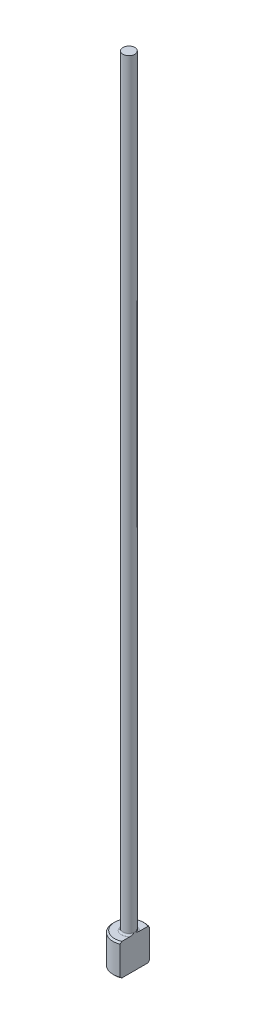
SolidWorks part; units mm, degrees
ref_plane "Front Plane" through (0, 0, 0) normal (0, 0, 1) x (1, 0, 0)
ref_plane "Top Plane" through (0, 0, 0) normal (0, 1, 0) x (1, 0, 0)
ref_plane "Right Plane" through (0, 0, 0) normal (1, 0, 0) x (0, 0, -1)
sketch "Sketch1" plane through (0, 0, 0) normal (0, 0, 1) x (1, 0, 0)
  line L0 (0, 259.9588) -> (0, -15.1925) construction
  line L1 (0, 0) -> (-2, 0)
  line L2 (-2, 0) -> (-2, 4)
  line L3 (-2, 4) -> (-0.75, 4)
  line L4 (-0.75, 4) -> (-0.75, 100)
  line L5 (-0.75, 100) -> (0, 100)
  line L6 (0, 100) -> (0, 0)
  dimension "L" = 100
  dimension "H" = 4
  dimension "T" = 4
  dimension "D" = 1.5
revolve "Revolve1" add sketch "Sketch1" angle 360 about L0
chamfer "Chamfer1" distance 0.2 angle 45 2 edges at (0, 4, 2) (0, 0, 2)
fillet "Fillet1" radius 0.2 1 edges at (0, 4, 0.75)
sketch "Sketch2" plane through (0, 0, 0) normal (0, 1, 0) x (1, 0, 0)
  line L0 (0.75, -1.854) -> (0.75, 1.854)
  circle A0 centre (0, 0) radius 2 construction
  arc A1 (0.75, -1.854) -> (0.75, 1.854) centre (0, 0) ccw
  circle A2 centre (0, 0) radius 0.75 construction
extrude "KEYED HEAD" cut sketch "Sketch2" along normal through all
